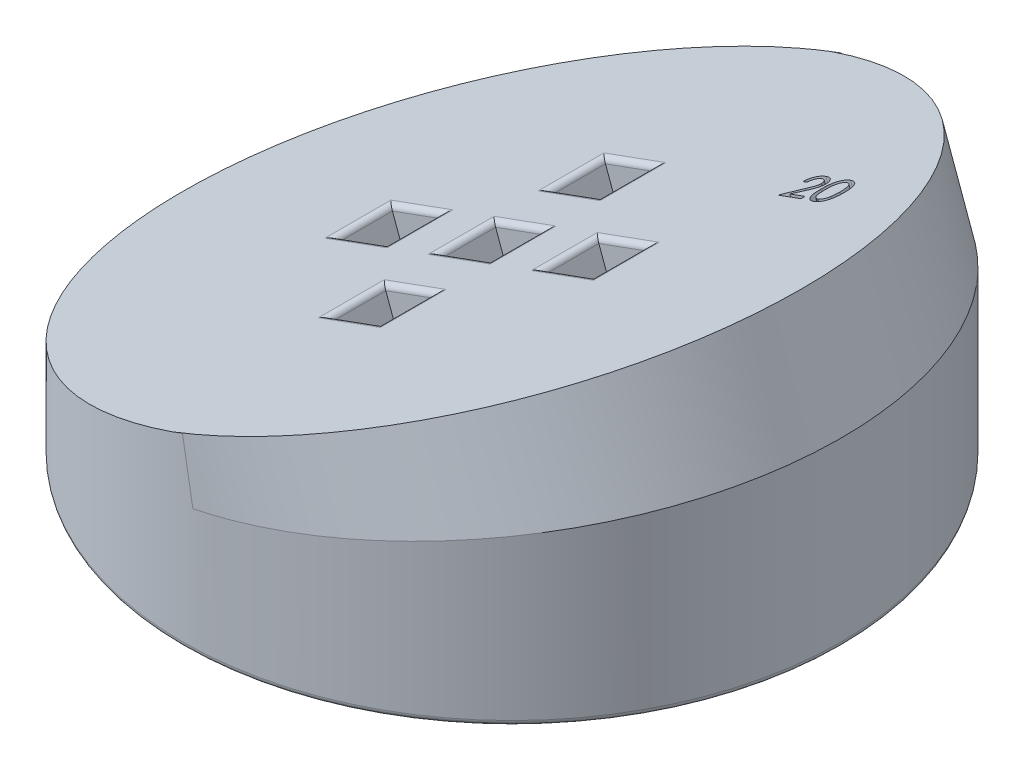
SolidWorks part; units mm, degrees
ref_plane "Front Plane" through (0, 0, 0) normal (0, 0, 1) x (1, 0, 0)
ref_plane "Top Plane" through (0, 0, 0) normal (0, 1, 0) x (1, 0, 0)
ref_plane "Right Plane" through (0, 0, 0) normal (1, 0, 0) x (0, 0, -1)
sketch "Sketch1" plane through (0, 0, 0) normal (0, 1, 0) x (1, 0, 0)
  circle A0 centre (0, 0) radius 30
extrude "Boss-Extrude1" add sketch "Sketch1" along normal blind 50
sketch "Sketch3" plane through (0, 50, 0) normal (0, 1, 0) x (1, 0, 0)
sketch "Sketch4" plane through (0, 0, 0) normal (0, -1, 0) x (-1, 0, 0)
  line L0 (0, 0) -> (-10, 0) construction
  line L1 (0, 0) -> (0, -10) construction
  line L2 (0, 0) -> (0, 10) construction
  line L3 (0, 0) -> (10, 0) construction
  line L5 (-2.5, 2.5) -> (2.5, 2.5)
  line L6 (-2.5, 2.5) -> (-2.5, -2.5)
  line L7 (-2.5, -2.5) -> (2.5, -2.5)
  line L8 (2.5, 2.5) -> (2.5, -2.5)
  line L9 (-2.5, 2.5) -> (2.5, -2.5) construction
  line L10 (-2.5, -2.5) -> (2.5, 2.5) construction
  line L11 (-2.5, -7.5) -> (2.5, -7.5)
  line L12 (-2.5, -7.5) -> (-2.5, -12.5)
  line L13 (-2.5, -12.5) -> (2.5, -12.5)
  line L14 (2.5, -7.5) -> (2.5, -12.5)
  line L15 (-2.5, -7.5) -> (2.5, -12.5) construction
  line L16 (-2.5, -12.5) -> (2.5, -7.5) construction
  line L17 (7.5, 2.5) -> (12.5, 2.5)
  line L18 (7.5, 2.5) -> (7.5, -2.5)
  line L19 (7.5, -2.5) -> (12.5, -2.5)
  line L20 (12.5, 2.5) -> (12.5, -2.5)
  line L21 (7.5, 2.5) -> (12.5, -2.5) construction
  line L22 (7.5, -2.5) -> (12.5, 2.5) construction
  line L23 (-12.5, 2.5) -> (-7.5, 2.5)
  line L24 (-12.5, 2.5) -> (-12.5, -2.5)
  line L25 (-12.5, -2.5) -> (-7.5, -2.5)
  line L26 (-7.5, 2.5) -> (-7.5, -2.5)
  line L27 (-12.5, 2.5) -> (-7.5, -2.5) construction
  line L28 (-12.5, -2.5) -> (-7.5, 2.5) construction
  line L29 (2.5, 7.5) -> (-2.5, 7.5)
  line L30 (2.5, 7.5) -> (2.5, 12.5)
  line L31 (2.5, 12.5) -> (-2.5, 12.5)
  line L32 (-2.5, 7.5) -> (-2.5, 12.5)
  line L33 (2.5, 7.5) -> (-2.5, 12.5) construction
  line L34 (2.5, 12.5) -> (-2.5, 7.5) construction
  dimension "D1" = 5
  dimension "D2" = 5
  dimension "D3" = 5
  dimension "D4" = 5
  dimension "D5" = 5
  dimension "D6" = 5
extrude "Cut-Extrude2" cut sketch "Sketch4" against normal blind 3
fillet "Fillet2" radius 0.5 21 edges at (0, 0, 30) (2.5, 0, 0) (0, 0, 2.5) (-2.5, 0, 0) (0, 0, -2.5) (2.5, 0, 10) (0, 0, 12.5) (-2.5, 0, 10) (0, 0, 7.5) (-7.5, 0, 0) (-10, 0, 2.5) (-12.5, 0, 0) (-10, 0, -2.5) (12.5, 0, 0) (10, 0, 2.5) (7.5, 0, 0) (10, 0, -2.5) (-2.5, 0, -10) (0, 0, -12.5) (2.5, 0, -10) (0, 0, -7.5)
ref_plane "Plane6" through (0, 0, 3.5) normal (0, 0, 1) x (1, 0, 0)
sketch "Sketch13" plane through (0, 0, 3.5) normal (0, 0, 1) x (1, 0, 0)
  line L0 (-30, 6) -> (30, 27.8382)
  line L1 (-30, 50) -> (-30, 0.5) construction
  line L2 (30, 0.5) -> (30, 50) construction
  line L3 (30, 27.8382) -> (30, 50)
  line L4 (30, 50) -> (-30, 50)
  line L5 (-30, 50) -> (-30, 6)
  line L6 (30, 0.5) -> (-30, 0.5) construction
  dimension "D1" = 5.5
  dimension "D2" = 20
extrude "Cut-Extrude10" cut sketch "Sketch13" against normal mid plane 90
ref_plane "Plane4" through (0, 0, -2.5) normal (0, 0, -1) x (-1, 0, 0)
ref_plane "Plane5" through (0, 0, -62.5) normal (0, 0, -1) x (-1, 0, 0)
sketch "Sketch15" plane through (-5.4377, 14.9399, 0) normal (-0.342, 0.9397, 0) x (0.9397, 0.342, 0)
  line L0 (-26.1387, 0) -> (0, 0) construction
  line L2 (-3.6387, -2.5) -> (-8.6387, -2.5)
  line L3 (-3.6387, -2.5) -> (-3.6387, 2.5)
  line L4 (-3.6387, 2.5) -> (-8.6387, 2.5)
  line L5 (-8.6387, -2.5) -> (-8.6387, 2.5)
  line L6 (-3.6387, -2.5) -> (-8.6387, 2.5) construction
  line L7 (-3.6387, 2.5) -> (-8.6387, -2.5) construction
  line L8 (6.3613, -2.5) -> (1.3613, -2.5)
  line L9 (6.3613, -2.5) -> (6.3613, 2.5)
  line L10 (6.3613, 2.5) -> (1.3613, 2.5)
  line L11 (1.3613, -2.5) -> (1.3613, 2.5)
  line L12 (6.3613, -2.5) -> (1.3613, 2.5) construction
  line L13 (6.3613, 2.5) -> (1.3613, -2.5) construction
  line L14 (16.3613, -2.5) -> (11.3613, -2.5)
  line L15 (16.3613, -2.5) -> (16.3613, 2.5)
  line L16 (16.3613, 2.5) -> (11.3613, 2.5)
  line L17 (11.3613, -2.5) -> (11.3613, 2.5)
  line L18 (16.3613, -2.5) -> (11.3613, 2.5) construction
  line L19 (16.3613, 2.5) -> (11.3613, -2.5) construction
  line L20 (6.3613, -12.5) -> (1.3613, -12.5)
  line L21 (6.3613, -12.5) -> (6.3613, -7.5)
  line L22 (6.3613, -7.5) -> (1.3613, -7.5)
  line L23 (1.3613, -12.5) -> (1.3613, -7.5)
  line L24 (6.3613, -12.5) -> (1.3613, -7.5) construction
  line L25 (6.3613, -7.5) -> (1.3613, -12.5) construction
  line L26 (6.3613, 7.5) -> (1.3613, 7.5)
  line L27 (6.3613, 7.5) -> (6.3613, 12.5)
  line L28 (6.3613, 12.5) -> (1.3613, 12.5)
  line L29 (1.3613, 7.5) -> (1.3613, 12.5)
  line L30 (6.3613, 7.5) -> (1.3613, 12.5) construction
  line L31 (6.3613, 12.5) -> (1.3613, 7.5) construction
  ellipse E0 centre (5.7867, 0) end of major axis (-26.1387, 0) minor radius 30 construction
  point P9 (-6.1387, 0)
  point P14 (3.8613, 0)
  point P19 (13.8613, 0)
  point P24 (3.8613, -10)
  point P29 (3.8613, 10)
  dimension "D1" = 40
  dimension "D2" = 30
  dimension "D3" = 20
  dimension "D4" = 5
  dimension "D5" = 5
  dimension "D6" = 5
  dimension "D7" = 5
  dimension "D8" = 5
  dimension "D9" = 5
  dimension "D10" = 5
  dimension "D11" = 5
  dimension "D12" = 10
  dimension "D13" = 10
  dimension "D14" = 5
  dimension "D15" = 5
extrude "Cut-Extrude11" cut sketch "Sketch15" against normal blind 3
ref_plane "Plane7" through (0, 0, 0) normal (0, 0, -1) x (-1, 0, 0)
sketch "Sketch24" plane through (-5.4377, 14.9399, 0) normal (-0.342, 0.9397, 0) x (0.9397, 0.342, 0)
  line L0 (3.8613, -30) -> (35.1643, -35.8499)
  line L1 (3.8613, 0) -> (-26.1387, 0)
  line L3 (35.1643, -35.8499) -> (45.7239, 0)
  line L4 (45.7239, 0) -> (28.8644, 38.5482)
  line L5 (28.8644, 38.5482) -> (3.8613, 34.4662)
  line L6 (3.8613, 34.4662) -> (3.8613, 30)
  arc A0 (3.8613, -30) -> (-26.1387, 0) centre (3.8613, 0) ccw
  ellipse E1 centre (5.7867, 0) end of major axis (-26.1387, 0) minor radius 30 construction
  dimension "D1" = 30
extrude "Cut-Extrude13" cut sketch "Sketch24" against normal blind 100 contours A0 M21
fillet "Fillet8" radius 0.5 4 edges at (-1.8092, 16.2606, -7.5) (0.54, 17.1157, -10) (-1.8092, 16.2606, -12.5) (-4.1585, 15.4056, -10)
fillet "Fillet9" radius 0.5 4 edges at (7.5877, 19.6808, 2.5) (9.9369, 20.5359, 0) (7.5877, 19.6808, -2.5) (5.2385, 18.8258, 0)
fillet "Fillet10" radius 0.5 4 edges at (-13.5554, 11.9854, 0) (-11.2061, 12.8404, 2.5) (-8.8569, 13.6955, 0) (-11.2061, 12.8404, -2.5)
fillet "Fillet11" radius 0.5 4 edges at (-4.1585, 15.4056, 10) (-1.8092, 16.2606, 12.5) (0.54, 17.1157, 10) (-1.8092, 16.2606, 7.5)
fillet "Fillet12" radius 0.5 4 edges at (-4.1585, 15.4056, 0) (-1.8092, 16.2606, 2.5) (0.54, 17.1157, 0) (-1.8092, 16.2606, -2.5)
sketch "Sketch25" plane through (-5.4377, 14.9399, 0) normal (-0.342, 0.9397, 0) x (0.9397, 0.342, 0)
  text T0 "<b>20</b>"
extrude "Cut-Extrude14" cut sketch "Sketch25" against normal blind 4
